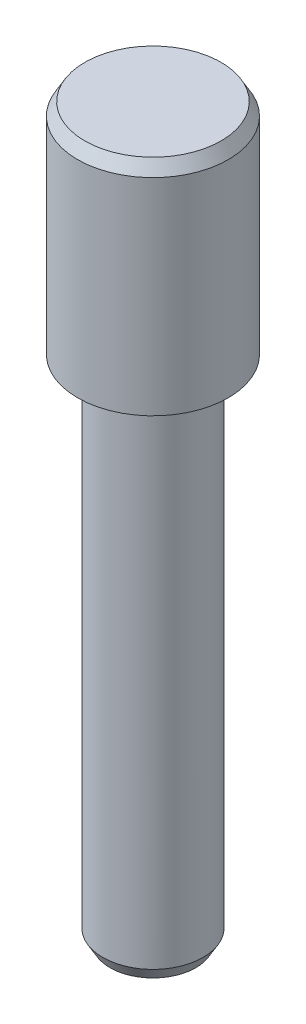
SolidWorks part; units mm, degrees
ref_plane "Plan de face" through (0, 0, 0) normal (0, 0, 1) x (1, 0, 0)
ref_plane "Plan de dessus" through (0, 0, 0) normal (0, 1, 0) x (1, 0, 0)
ref_plane "Plan de droite" through (0, 0, 0) normal (1, 0, 0) x (0, 0, -1)
sketch "Esquisse1" plane through (0, 0, 0) normal (0, 1, 0) x (1, 0, 0)
  circle A0 centre (0, 0) radius 3
  dimension "D1" = 6
extrude "Boss.-Extru.1" add sketch "Esquisse1" against normal blind 9
chamfer "Chanfrein1" distance 0.5 angle 30 2 edges at (0, 0, 3) (0, -9, 3)
sketch "Esquisse2" plane through (0, -9, 0) normal (0, -1, 0) x (1, 0, 0)
  circle A0 centre (0, 0) radius 2
  dimension "D1" = 4
extrude "Boss.-Extru.2" add sketch "Esquisse2" along normal blind 20
chamfer "Chanfrein2" distance 0.5 angle 30 1 edges at (0, -29, -2)
